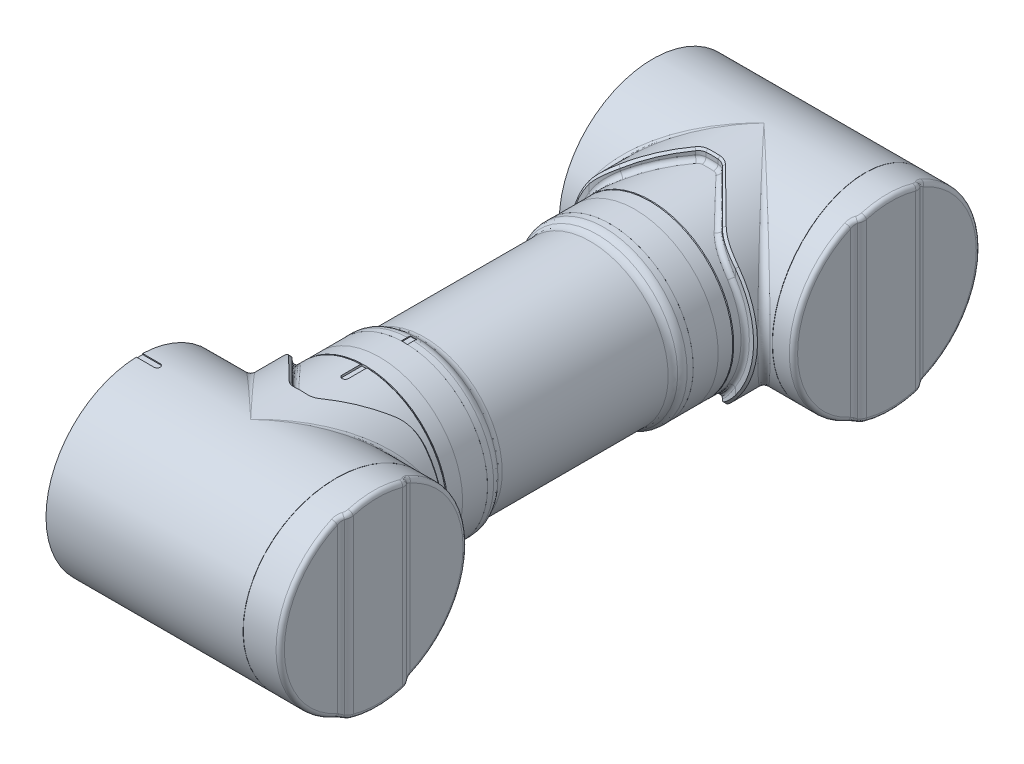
SolidWorks part; units mm, degrees
ref_plane "前视基准面" through (0, 0, 0) normal (0, 0, 1) x (1, 0, 0)
ref_plane "上视基准面" through (0, 0, 0) normal (0, 1, 0) x (1, 0, 0)
ref_plane "右视基准面" through (0, 0, 0) normal (1, 0, 0) x (0, 0, -1)
imported_body "输入1"
sketch "草图1" plane through (0, 0, -161.5) normal (0, 0, 1) x (1, 0, 0)
  circle A0 centre (115.5, 0) radius 40 construction
  circle A1 centre (115.5, 0) radius 40
  circle A2 centre (115.5, 0) radius 38
  dimension "D1" = 2
extrude "切除-拉伸1" cut sketch "草图1" against normal blind 19
sketch "草图2" plane through (0, 0, -298.5) normal (0, 0, -1) x (-1, 0, 0)
  circle A0 centre (-115.5, 0) radius 40 construction
  circle A1 centre (-115.5, 0) radius 40
  circle A4 centre (-115.5, 0) radius 38
  circle A5 centre (-115.5, 0) radius 38
  dimension "D1" = 2
extrude "切除-拉伸2" cut sketch "草图2" against normal blind 19
sketch "草图3" plane through (0, 0, -161.5) normal (0, 0, -1) x (-1, 0, 0)
  circle A0 centre (-115.5, 0) radius 38 construction
  circle A1 centre (-115.5, 0) radius 38
  circle A2 centre (-115.5, 0) radius 40
  dimension "D1" = 2
extrude "凸台-拉伸1" add sketch "草图3" along normal blind 7 separate body
sketch "草图4" plane through (0, 0, -168.5) normal (0, 0, -1) x (-1, 0, 0)
  circle A0 centre (-115.5, 0) radius 38 construction
  circle A1 centre (-115.5, 0) radius 38
  circle A2 centre (-115.5, 0) radius 40 construction
  circle A3 centre (-115.5, 0) radius 40
extrude "凸台-拉伸2" add sketch "草图4" along normal blind 12 separate body
sketch "草图5" plane through (0, 0, -279.5) normal (0, 0, -1) x (-1, 0, 0)
  circle A0 centre (-115.5, 0) radius 38 construction
  circle A1 centre (-115.5, 0) radius 38
  circle A3 centre (-115.5, 0) radius 40
  dimension "D1" = 2
extrude "凸台-拉伸3" add sketch "草图5" along normal blind 12 separate body
sketch "草图6" plane through (0, 0, -291.5) normal (0, 0, -1) x (-1, 0, 0)
  circle A0 centre (-115.5, 0) radius 38 construction
  circle A1 centre (-115.5, 0) radius 38
  circle A2 centre (-115.5, 0) radius 40 construction
  circle A3 centre (-115.5, 0) radius 40
extrude "凸台-拉伸4" add sketch "草图6" along normal blind 7 separate body
ref_plane "基准面1" through (0, 40, 0) normal (0, 1, 0) x (1, 0, 0)
sketch "草图8" plane through (62, 0, 0) normal (-1, 0, 0) x (0, 0, 1)
  line L1 (-355, -44.5) -> (-352, -44.5)
  line L2 (-355, -44.5) -> (-355, -45.5)
  line L3 (-355, -45.5) -> (-352, -45.5)
  line L4 (-352, -44.5) -> (-352, -45.5)
  line L5 (-355, -44.5) -> (-352, -45.5) construction
  line L6 (-355, -45.5) -> (-352, -44.5) construction
  line L7 (-108, 45.5) -> (-105, 45.5)
  line L8 (-108, 45.5) -> (-108, 44.5)
  line L9 (-108, 44.5) -> (-105, 44.5)
  line L10 (-105, 45.5) -> (-105, 44.5)
  line L11 (-108, 45.5) -> (-105, 44.5) construction
  line L12 (-108, 44.5) -> (-105, 45.5) construction
  circle A0 centre (-353.5, 0) radius 45 construction
  arc A1 (-395.5, -16.1555) -> (-395.5, 16.1555) centre (-353.5, 0) ccw construction
  arc A2 (-64.5, 16.1555) -> (-64.5, -16.1555) centre (-106.5, 0) ccw construction
  circle A3 centre (-106.5, 0) radius 45 construction
  point P0 (-353.5, -45)
  point P10 (-106.5, 45)
  dimension "D3" = 3
  dimension "D1" = 3
  dimension "D2" = 44.5
  dimension "D4" = 44.5
extrude "切除-拉伸3" cut sketch "草图8" against normal blind 10
fillet "圆角1" [suppressed] radius 1.5
sketch "草图9" plane through (176.7, 0, 0) normal (1, 0, 0) x (0, 0, -1)
  circle A0 centre (108.4694, -4.3514) radius 49.8234
extrude "切除-拉伸4" cut sketch "草图9" along normal blind 10
sketch "草图10" plane through (176.7, 0, 0) normal (1, 0, 0) x (0, 0, -1)
sketch_block_instance "TURIN-LOGO-2"
sketch_block "TURIN-LOGO"
wrap "包覆1" [suppressed] sketch "草图10" source sketch "草图10" thickness 1 parameters "D1"=1
sketch "草图11" plane through (172.2, 0, 0) normal (1, 0, 0) x (0, 0, -1)
  circle A1 centre (380.3701, -26.8701) radius 3
  circle A2 centre (380.3701, -26.8701) radius 3
  circle A3 centre (380.3701, 26.8701) radius 3
  circle A4 centre (380.3701, 26.8701) radius 3
  circle A5 centre (326.6299, 26.8701) radius 3
  circle A6 centre (326.6299, 26.8701) radius 3
  circle A7 centre (326.6299, -26.8701) radius 3
  circle A8 centre (326.6299, -26.8701) radius 3
  circle A9 centre (133.3701, 26.8701) radius 3
  circle A10 centre (133.3701, 26.8701) radius 3
  circle A11 centre (133.3701, -26.8701) radius 3
  circle A12 centre (133.3701, -26.8701) radius 3
  circle A13 centre (79.6299, 26.8701) radius 3
  circle A14 centre (79.6299, 26.8701) radius 3
  circle A15 centre (79.6299, -26.8701) radius 3
  circle A16 centre (79.6299, -26.8701) radius 3
  dimension "D1" = 0
  dimension "D2" = 0
  dimension "D3" = 0
  dimension "D4" = 0
  dimension "D5" = 0
  dimension "D6" = 0
  dimension "D7" = 0
  dimension "D8" = 0
extrude "凸台-拉伸5" add sketch "草图11" along normal up to surface (2.5 mm away)
sketch "草图12" plane through (0, 0, 0) normal (0, 1, 0) x (1, 0, 0)
  line L0 (164.7505, 306.5) -> (156.7, 400.5)
  line L1 (164.7505, 153.5) -> (156.7, 59.5)
extrude "切除-拉伸-薄壁1" cut sketch "草图12" against normal through all and the other way through all thin
sketch "草图13" plane through (174.7, 0, 0) normal (1, 0, 0) x (0, 0, -1)
  arc A0 (355, -44.975) -> (352, -44.975) centre (353.5, 0) ccw construction
  circle A1 centre (353.5, 0) radius 45
  circle A2 centre (353.5, 0) radius 55
  dimension "D1" = 110
extrude "切除-拉伸6" cut sketch "草图13" against normal up to surface (14.2009 mm away)
sketch "草图14" plane through (174.7, 0, 0) normal (1, 0, 0) x (0, 0, -1)
  arc A0 (105, 44.975) -> (108, 44.975) centre (106.5, 0) ccw construction
  circle A1 centre (106.5, 0) radius 45
  circle A2 centre (106.5, 0) radius 55
  dimension "D1" = 110
extrude "切除-拉伸7" cut sketch "草图14" against normal up to surface (10.1304 mm away)
sketch "草图15" plane through (176.7, 0, 0) normal (1, 0, 0) x (0, 0, -1)
  line L2 (341.6928, 41.3472) -> (341.6928, -41.3472)
  line L3 (365.3072, -41.3472) -> (365.3072, 41.3472)
  line L4 (341.6928, 41.3472) -> (341.6928, -41.3472)
  line L5 (365.3072, -41.3472) -> (365.3072, 41.3472)
  arc A2 (341.6928, -41.3472) -> (365.3072, -41.3472) centre (353.5, 0) ccw
  arc A3 (365.3072, 41.3472) -> (341.6928, 41.3472) centre (353.5, 0) ccw
  arc A4 (341.6928, -41.3472) -> (365.3072, -41.3472) centre (353.5, 0) ccw
  arc A5 (365.3072, 41.3472) -> (341.6928, 41.3472) centre (353.5, 0) ccw
  dimension "D1" = 0
extrude "切除-拉伸8" cut sketch "草图15" along normal blind 10
fillet "圆角2" radius 1.5 6 edges at (114, 39.4859, -150.5) (117, 39.4859, -150.5) (117, -39.4859, -309.5) (114, -39.4859, -309.5) (72, 44.7375, -105) (72, 44.7375, -108)
